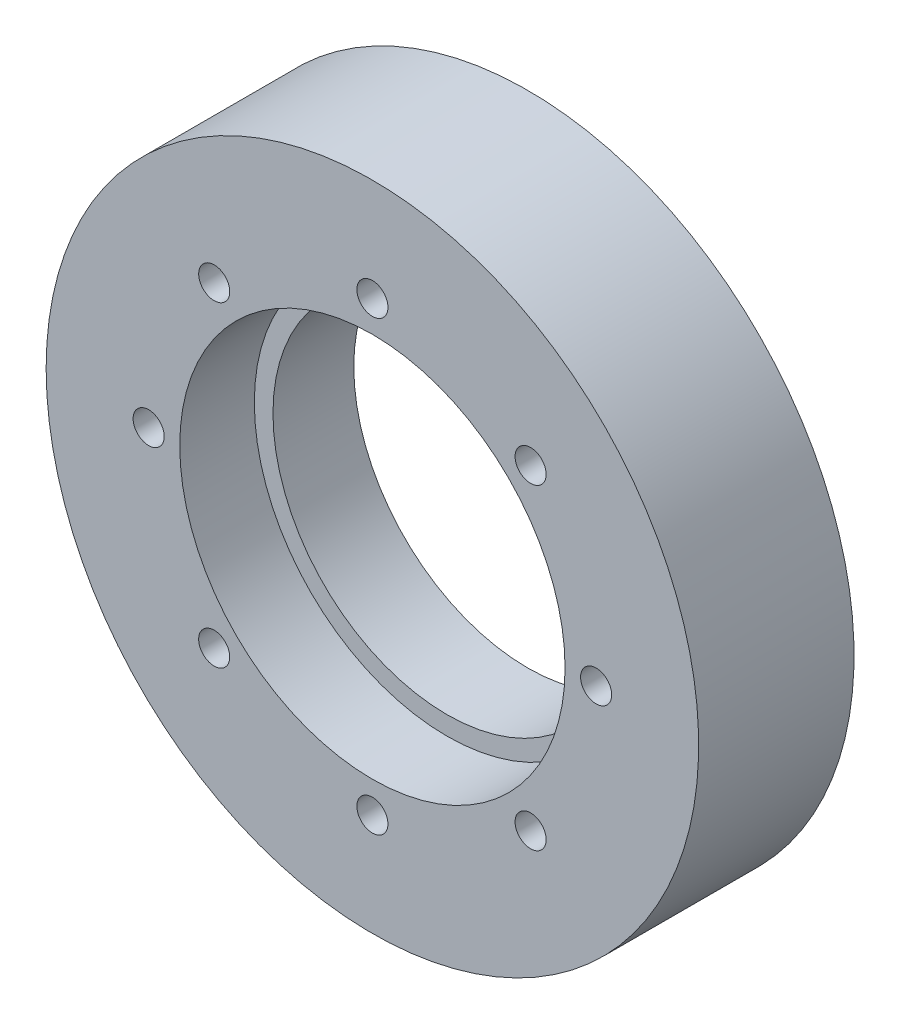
SolidWorks part; units mm, degrees
ref_plane "Front Plane" through (0, 0, 0) normal (0, 0, 1) x (1, 0, 0)
ref_plane "Top Plane" through (0, 0, 0) normal (0, 1, 0) x (1, 0, 0)
ref_plane "Right Plane" through (0, 0, 0) normal (1, 0, 0) x (0, 0, -1)
sketch "Sketch1" plane through (0, 0, 0) normal (0, 1, 0) x (1, 0, 0)
  line L1 (40, 12.5) -> (0, 12.5)
  line L3 (40, -12.5) -> (0, -12.5)
  line L4 (0, 12.5) -> (0, -12.5)
  line L5 (40, 12.5) -> (52.5, 12.5)
  line L6 (40, 12.5) -> (40, -12.5)
  line L7 (40, -12.5) -> (52.5, -12.5)
  line L8 (52.5, 12.5) -> (52.5, -12.5)
  arc A1 (40, -12.5) -> (40, 12.5) centre (40, 0) ccw
  dimension "D2" = 25
  dimension "D1" = 40
revolve "Revolve1" add sketch "Sketch1" angle 360 about L4
sketch "Sketch5" plane through (0, 0, -12.5) normal (0, 0, -1) x (-1, 0, 0)
  circle A0 centre (0, 0) radius 31
  dimension "D1" = 62
extrude "Cut-Extrude2" cut sketch "Sketch5" against normal blind 30
sketch "Sketch6" plane through (0, 0, -12.5) normal (0, 0, -1) x (-1, 0, 0)
  circle A0 centre (0, 0) radius 36 construction
  circle A1 centre (36, 0) radius 2.5
  circle A2 centre (25.4558, -25.4558) radius 2.5
  circle A3 centre (0, -36) radius 2.5
  circle A4 centre (-25.4558, -25.4558) radius 2.5
  circle A5 centre (-36, 0) radius 2.5
  circle A6 centre (-25.4558, 25.4558) radius 2.5
  circle A7 centre (0, 36) radius 2.5
  circle A8 centre (25.4558, 25.4558) radius 2.5
  point P22 (0, 0)
  dimension "D1" = 72
  dimension "D2" = 5
  dimension "D3" = 8
extrude "Cut-Extrude3" cut sketch "Sketch6" against normal blind 30
sketch "Sketch7" plane through (0, 0, -12.5) normal (0, 0, -1) x (-1, 0, 0)
  circle A0 centre (0, 0) radius 28
  circle A1 centre (0, 0) radius 31
  dimension "D1" = 56
extrude "Boss-Extrude1" add sketch "Sketch7" against normal blind 13
ref_plane "Plane1" through (0, 60, 0) normal (0, 1, 0) x (1, 0, 0)
sketch "Sketch8" plane through (0, 60, 0) normal (0, 1, 0) x (1, 0, 0)
  line L0 (-11.4679, 9.0442) -> (-4.4679, 9.0442) construction
  line L1 (-4.4679, 9.0442) -> (2.5321, 9.0442) construction
  line L2 (6.8107, 5.7977) -> (8.5915, 4.0169)
  line L3 (6.8107, 5.7977) -> (8.4565, 7.6975)
  line L4 (1.7524, 2.3407) -> (1.2891, 0.7516)
  line L5 (-1.5297, 3.889) -> (-3.3279, 1.9116)
  spline S0 degree 3 poles (-4.4679, 9.0442) (-3.3333, 1.0025) (6.1209, 1.6004) (12.0095, 1.3398) knots 0 0 0 0 1 1 1 1
  spline S1 degree 2 poles (2.5321, 9.0442) (3.6091, 6.217) (6.8107, 5.7977) knots 0 0 0 1 1 1
  spline S2 degree 2 poles (-11.4679, 9.0442) (-10.9596, 5.8451) (-7.5258, 5.1574) knots 0 0 0 1 1 1
  dimension "D1" = 7
  dimension "D2" = 7
extrude "Cut-Extrude-Thin2" [suppressed] cut sketch "Sketch8" against normal blind 11 thin contours S0 | S2 | S1 | L3 | L2 | L5 | L4
sketch "Sketch9" plane through (0, 0, 0) normal (0, 1, 0) x (1, 0, 0)
  line L0 (0, 0) -> (0, 21.4834) construction
ref_plane "Plane2" through (0, 0, 0) normal (0, 0, -1) x (-1, 0, 0)
mirror "Mirror1" [suppressed] about plane through (0, 0, 0) normal (0, 0, -1)
pattern_circular "CirPattern1" [suppressed] count 16 over 360 about axis through (0, 0, 0) along (0, 0, -1)
